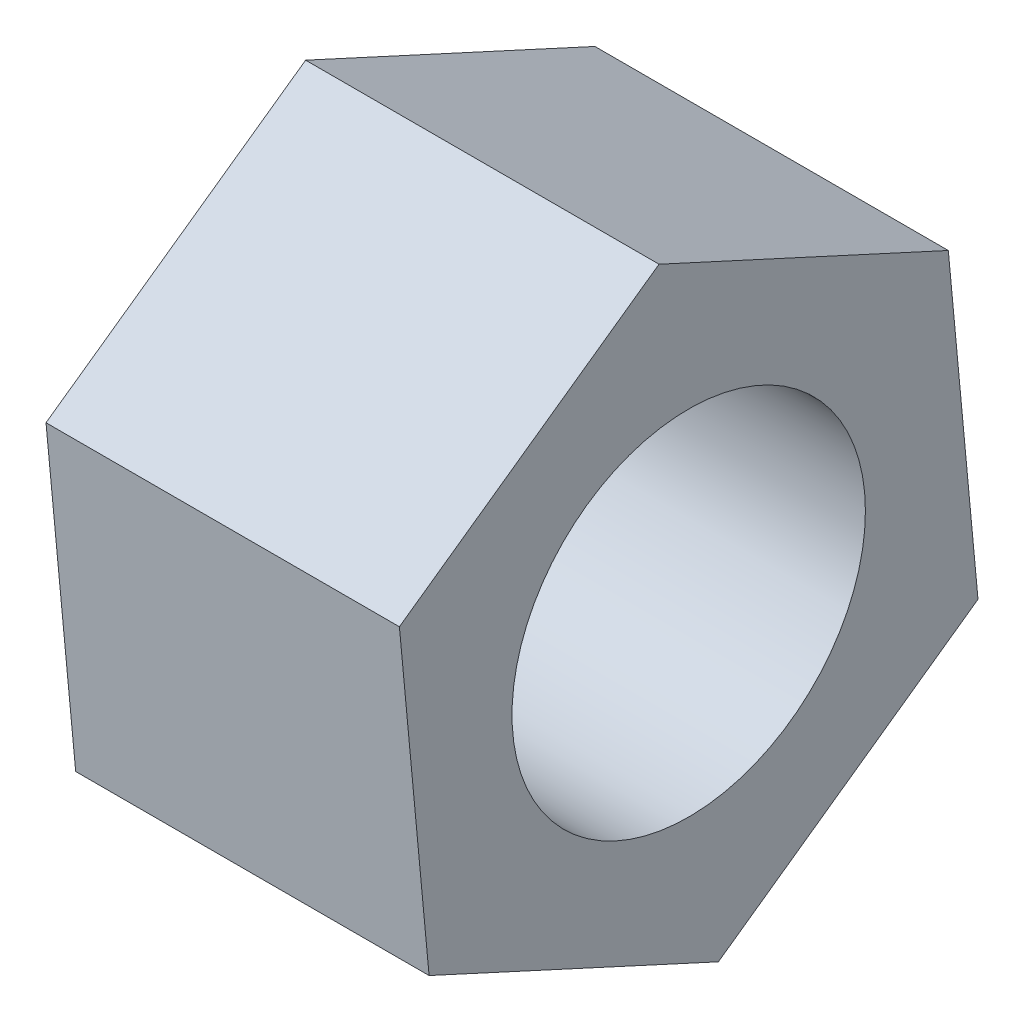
SolidWorks part; units mm, degrees
ref_plane "Front" through (0, 0, 0) normal (0, 0, 1) x (1, 0, 0)
ref_plane "Top" through (0, 0, 0) normal (0, 1, 0) x (1, 0, 0)
ref_plane "Right" through (0, 0, 0) normal (1, 0, 0) x (0, 0, -1)
sketch "Sketch1" plane through (0, 0, 0) normal (1, 0, 0) x (0, 0, -1)
  line L1 (-30.5403, 17.1575) -> (-29.8057, 17.6787)
  line L2 (-29.8057, 17.6787) -> (-29.8897, 18.5754)
  line L3 (-29.8897, 18.5754) -> (-30.7083, 18.951)
  line L4 (-30.7083, 18.951) -> (-31.4429, 18.4299)
  line L5 (-31.4429, 18.4299) -> (-31.3589, 17.5332)
  line L6 (-31.3589, 17.5332) -> (-30.5403, 17.1575)
  circle A0 centre (-30.6243, 18.0543) radius 0.78 construction
  circle A1 centre (-30.6243, 18.0543) radius 0.5
  dimension "D1" = 1.56
extrude "Boss-Extrude1" add sketch "Sketch1" along normal blind 1
